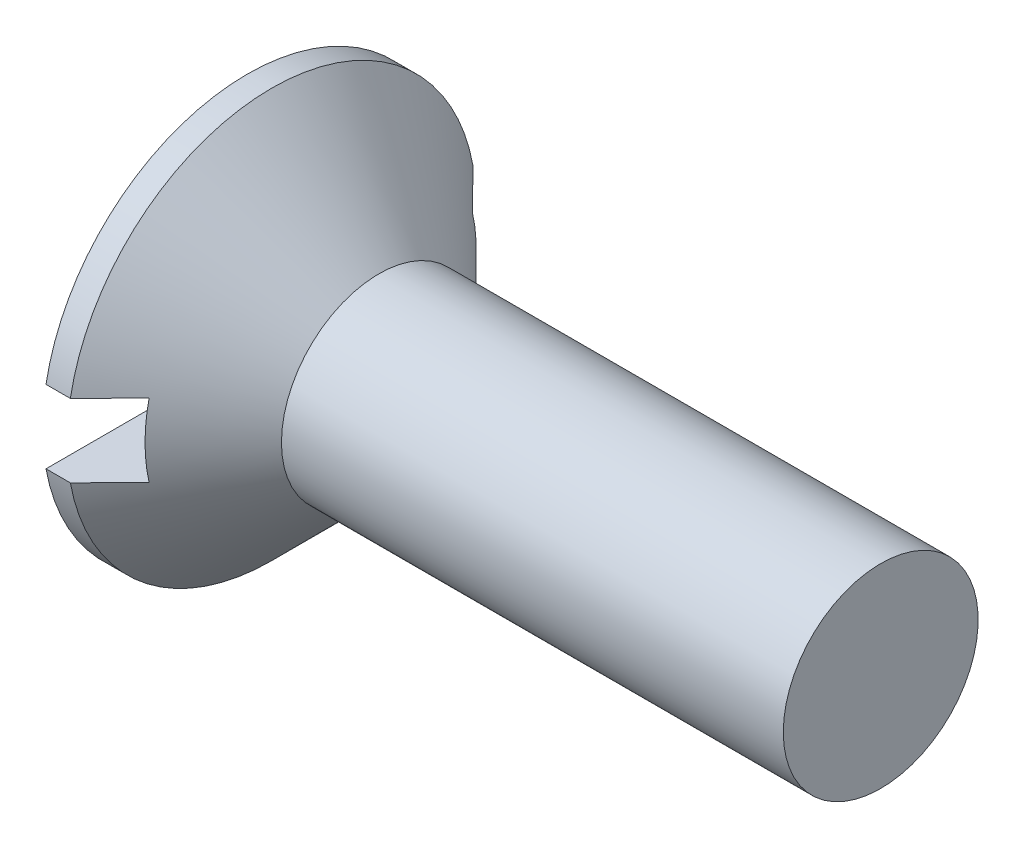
SolidWorks part; units mm, degrees
ref_plane "Plane1" through (0, 0, 0) normal (0, 0, 1) x (1, 0, 0)
ref_plane "Plane2" through (0, 0, 0) normal (0, 1, 0) x (1, 0, 0)
ref_plane "Plane3" through (0, 0, 0) normal (1, 0, 0) x (0, 0, -1)
revolve "Base-Revolve" add sketch "BodySke" angle 360 about L5
sketch "BodySke" plane through (0, 0, 0) normal (0, 0, 1) x (1, 0, 0)
  line L0 (0, 0) -> (0, 4.2)
  line L1 (0, 4.2) -> (0.5, 4.2)
  line L2 (2.7, 2) -> (13, 2)
  line L3 (13, 2) -> (13, 0)
  line L4 (13, 0) -> (0, 0)
  line L5 (-6.35, 0) -> (82.55, 0) construction
  line L6 (2.7, -2) -> (13, -2) construction
  line L7 (0.5, -4.2) -> (2.7, -2) construction
  line L8 (0.5, 4.2) -> (2.7, 2)
  line L9 (0, -4.2) -> (0.5, -4.2) construction
  line L10 (3.4, 3.5875) -> (3.4, -5.9375) construction
  line L11 (0, 6.35) -> (0, -3.175) construction
  dimension "Diameter" = 4
  dimension "Length" = 13
  dimension "Head_ht" = 2.7
  dimension "Head_dia" = 8.4
  dimension "Head_ang" = 90
  dimension "D6" = 0.5
  dimension "Advance" = 0.7
  dimension "Thread_nom" = 13
extrude "Slot" cut sketch "Sketch2" against normal blind 1.3
sketch "Sketch2" plane through (0, 0, 0) normal (-1, 0, 0) x (0, 0, 1)
  line L0 (-4.2, -0.75) -> (4.2, -0.75)
  line L1 (-4.2, -0.75) -> (-4.2, 0.75)
  line L2 (4.2, 0.75) -> (-4.2, 0.75)
  line L3 (4.2, 0.75) -> (4.2, -0.75)
  dimension "D1" = 0.75
  dimension "Slot_width" = 1.5
  dimension "D2" = 8.4
  dimension "D3" = 4.2
sketch "Sketch3" plane through (0, 0, 0) normal (-1, 0, 0) x (0, 0, 1)
  line L0 (-0.48, 2.23) -> (0.48, 2.23)
  line L1 (0.48, 2.23) -> (0.48, -2.23)
  line L2 (0.48, -2.23) -> (-0.48, -2.23)
  line L3 (-0.48, -2.23) -> (-0.48, 2.23)
  dimension "D1" = 2.23
  dimension "Cross_dia" = 4.46
  dimension "D2" = 0.48
  dimension "Cross_width" = 0.96
ref_plane "Plane4" through (2.65, 0, 0) normal (-1, 0, 0) x (0, 0, 1)
sketch "Sketch4" plane through (2.65, 0, 0) normal (-1, 0, 0) x (0, 0, 1)
  line L0 (-0.24, 0.24) -> (0.24, 0.24)
  line L3 (0.24, 0.24) -> (0.24, -0.24)
  line L4 (0.24, -0.24) -> (-0.24, -0.24)
  line L5 (-0.24, -0.24) -> (-0.24, 0.24)
  dimension "D1" = 0.48
  dimension "D2" = 0.48
  dimension "D3" = 0.24
  dimension "D4" = 0.24
loft "Cross" cut profiles "Sketch3", "Sketch4"
pattern_circular "CirPattern1" count 2 every 90 about axis through (-6.35, 0, 0) along (1, 0, 0)
sketch "ThdSchSke" plane through (0, 0, 0) normal (0, 0, 1) x (1, 0, 0)
  line L0 (3.4, -1.61) -> (3.1269, -2)
  line L1 (3.4, -1.61) -> (3.6731, -2)
  line L2 (3.6731, -2) -> (3.6731, -2.5)
  line L3 (-3.175, 0) -> (5.1513, 0) construction
  line L5 (3.6731, -2.5) -> (3.1269, -2.5)
  line L6 (3.1269, -2.5) -> (3.1269, -2)
  line L7 (0, 4.2) -> (0, 0.75) construction
  dimension "Thread_minor" = 3.22
  dimension "Diameter" = 4
  dimension "Start" = 3.4
  dimension "SideAngle" = 55
  dimension "VeeAngle" = 70
  dimension "Overcut" = 5
revolve "ThreadSchematic" cut sketch "ThdSchSke" angle 360 about L3
pattern_linear "ThdSchPat"
equation "\"D1@Sketch3\" = \"Cross_dia@Sketch3\" / 2"
equation "\"D2@Sketch3\" = \"Cross_width@Sketch3\" / 2"
equation "\"D1@Sketch4\" = \"Cross_width@Sketch3\" *.5"
equation "\"D2@Sketch4\" = \"D1@Sketch4\""
equation "\"D4@Sketch4\" = \"D2@Sketch4\" / 2"
equation "\"D3@Sketch4\" = \"D1@Sketch4\" / 2"
equation "\"D1@Sketch2\" = \"Slot_width@Sketch2\" / 2"
equation "\"D2@Sketch2\" = \"Head_dia@BodySke\""
equation "\"D3@Sketch2\" = \"D2@Sketch2\" / 2"
equation "\"Thread_length@ThreadCosmetic\" = ((sgn( (\"Length@BodySke\" - \"Advance@BodySke\" - \"Head_ht@BodySke\" ) - \"Thread_nom@BodySke\" )-1)*( (\"Length@BodySke\" - \"Advance@BodySke\" - \"Head_ht@BodySke\" ) - \"Thread_"
equation "\"Thread_minor@ThdSchSke\" = \"Thread_minor@ThreadCosmetic\""
equation "\"Diameter@ThdSchSke\" = \"Diameter@BodySke\""
equation "\"Overcut@ThdSchSke\" = \"Diameter@BodySke\" * 1.25"
equation "\"Start@ThdSchSke\" = 0.000001 + \"Length@BodySke\" - \"Thread_length@ThreadCosmetic\"  '---Countersunk---"
equation "\"Num_threads@ThdSchPat\" = int( \"Thread_length@ThreadCosmetic\" / \"Advance@BodySke\" + 0.999 )  + 1"
equation "\"Advance@ThdSchPat\" = \"Thread_length@ThreadCosmetic\" /  (\"Num_threads@ThdSchPat\" - 1) 'relax it"
